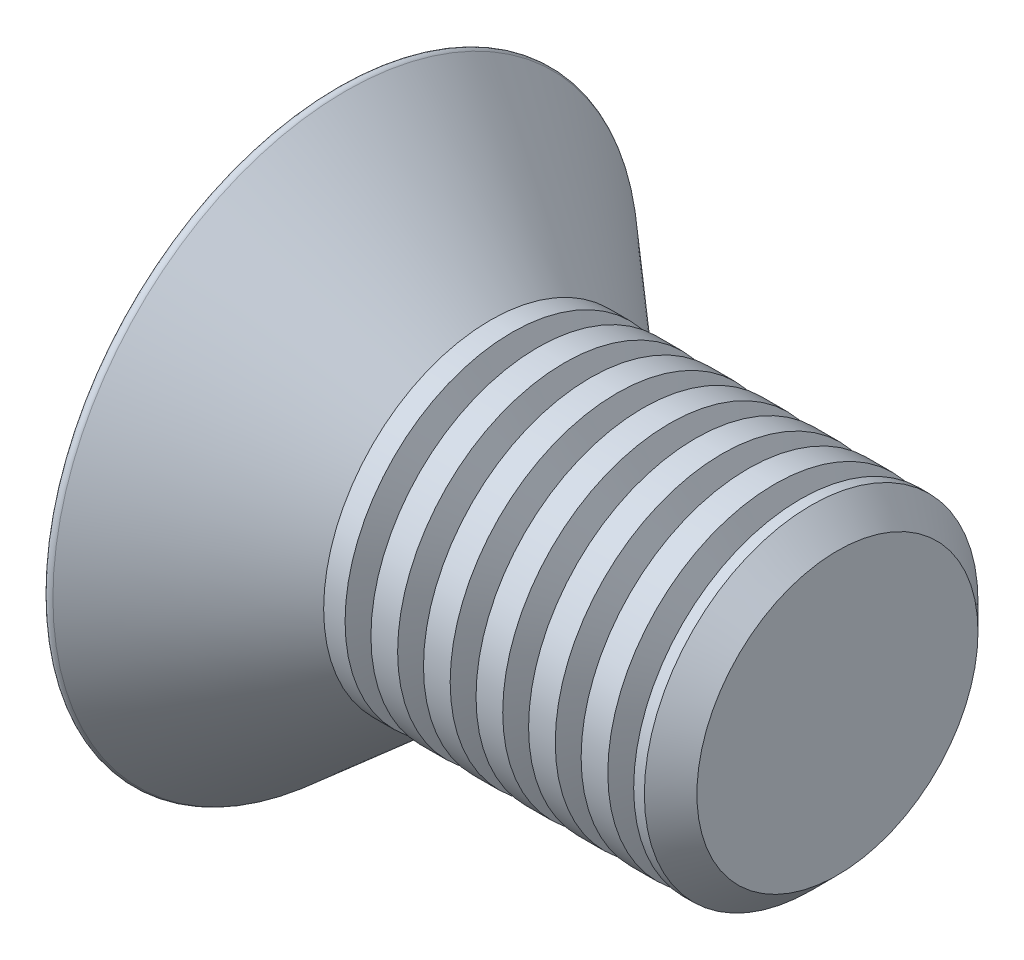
SolidWorks part; units mm, degrees
ref_plane "Front Plane" through (0, 0, 0) normal (0, 0, 1) x (1, 0, 0)
ref_plane "Top Plane" through (0, 0, 0) normal (0, 1, 0) x (1, 0, 0)
ref_plane "Right Plane" through (0, 0, 0) normal (1, 0, 0) x (0, 0, -1)
sketch "Sketch1" plane through (0, 0, 0) normal (0, 0, 1) x (1, 0, 0)
  line L0 (0, 0) -> (0, -1.5875)
  line L1 (0, -1.5875) -> (-0.1265, -1.5875)
  line L2 (-0.1265, -1.5875) -> (-1.5875, -2.8575)
  line L3 (-1.5875, -2.8575) -> (-1.5875, 0)
  line L4 (-1.5875, 0) -> (0, 0)
revolve "Revolve1" add sketch "Sketch1" angle 360 about L4
fillet "Fillet1" radius 0.05 1 edges at (-1.5875, 0, 2.8575)
sketch "Sketch2" plane through (-1.5875, 0, 0) normal (-1, 0, 0) x (0, 0, 1)
  line L0 (0, 0) -> (0, 2.7478) construction
  line L1 (0, 0) -> (-2.7478, 0) construction
  line L2 (-0.25, 1.85) -> (-0.25, 0.25)
  line L3 (-0.25, 0.25) -> (-1.85, 0.25)
  line L4 (0.25, 1.85) -> (0.25, 0.25)
  line L5 (0.25, 0.25) -> (1.85, 0.25)
  line L6 (0.25, -0.25) -> (1.85, -0.25)
  line L7 (0.25, -1.85) -> (0.25, -0.25)
  line L8 (-0.25, -0.25) -> (-1.85, -0.25)
  line L9 (-0.25, -1.85) -> (-0.25, -0.25)
  line L10 (-1.85, 0.25) -> (-1.85, -0.25)
  line L11 (-0.25, -1.85) -> (0.25, -1.85)
  line L12 (1.85, -0.25) -> (1.85, 0.25)
  line L13 (0.25, 1.85) -> (-0.25, 1.85)
  circle A0 centre (0, 0) radius 2.7478 construction
  dimension "D1" = 0.25
  dimension "D2" = 0.25
  dimension "D3" = 1.6
  dimension "D4" = 1.6
extrude "Cut-Extrude1" cut sketch "Sketch2" against normal blind 0.5
fillet "Fillet2" radius 0.5 4 edges at (-1.3375, -0.25, 0.25) (-1.3375, -0.25, -0.25) (-1.3375, 0.25, 0.25) (-1.3375, 0.25, -0.25)
sketch "Sketch3" plane through (0, 0, 0) normal (1, 0, 0) x (0, 0, -1)
  circle A1 centre (0, 0) radius 1.5875
  circle A2 centre (0, 0) radius 1.5875
  dimension "D1" = 0
extrude "Boss-Extrude1" add sketch "Sketch3" along normal blind 3.175
chamfer "Chamfer1" distance 0.25 angle 45 1 edges at (3.175, 0, -1.5875)
sketch "Sketch5" plane through (0, 0, 0) normal (0, 0, 1) x (1, 0, 0)
  line L0 (0.011, 1.7357) -> (0.2004, 1.3127)
  line L1 (0.2004, 1.3127) -> (0.3898, 1.7357)
  line L2 (0.3898, 1.7357) -> (0.011, 1.7357)
  line L3 (0, 0) -> (2.925, 0) construction
  line L4 (2.925, -1.5875) -> (2.925, 1.5875) construction
  line L5 (0.5, 0) -> (3.425, 0) construction
  line L6 (0.511, 1.7357) -> (0.7004, 1.3127)
  line L7 (0.7004, 1.3127) -> (0.8898, 1.7357)
  line L8 (0.8898, 1.7357) -> (0.511, 1.7357)
  line L9 (1, 0) -> (3.925, 0) construction
  line L10 (1.011, 1.7357) -> (1.2004, 1.3127)
  line L11 (1.2004, 1.3127) -> (1.3898, 1.7357)
  line L12 (1.3898, 1.7357) -> (1.011, 1.7357)
  line L13 (1.5, 0) -> (4.425, 0) construction
  line L14 (1.511, 1.7357) -> (1.7004, 1.3127)
  line L15 (1.7004, 1.3127) -> (1.8898, 1.7357)
  line L16 (1.8898, 1.7357) -> (1.511, 1.7357)
  line L17 (2, 0) -> (4.925, 0) construction
  line L18 (2.011, 1.7357) -> (2.2004, 1.3127)
  line L19 (2.2004, 1.3127) -> (2.3898, 1.7357)
  line L20 (2.3898, 1.7357) -> (2.011, 1.7357)
  line L21 (2.5, 0) -> (5.425, 0) construction
  line L22 (2.511, 1.7357) -> (2.7004, 1.3127)
  line L23 (2.7004, 1.3127) -> (2.8898, 1.7357)
  line L24 (2.8898, 1.7357) -> (2.511, 1.7357)
  line L25 (3, 0) -> (5.925, 0) construction
  line L26 (3.011, 1.7357) -> (3.2004, 1.3127)
  line L27 (3.2004, 1.3127) -> (3.3898, 1.7357)
  line L28 (3.3898, 1.7357) -> (3.011, 1.7357)
  line L29 (3.5, 0) -> (6.425, 0) construction
  line L30 (3.511, 1.7357) -> (3.7004, 1.3127)
  line L31 (3.7004, 1.3127) -> (3.8898, 1.7357)
  line L32 (3.8898, 1.7357) -> (3.511, 1.7357)
  line L33 (4, 0) -> (6.925, 0) construction
  line L34 (4.011, 1.7357) -> (4.2004, 1.3127)
  line L35 (4.2004, 1.3127) -> (4.3898, 1.7357)
  line L36 (4.3898, 1.7357) -> (4.011, 1.7357)
  dimension "D1" = 9
revolve "Cut-Revolve1" cut sketch "Sketch5" angle 360 about L3
